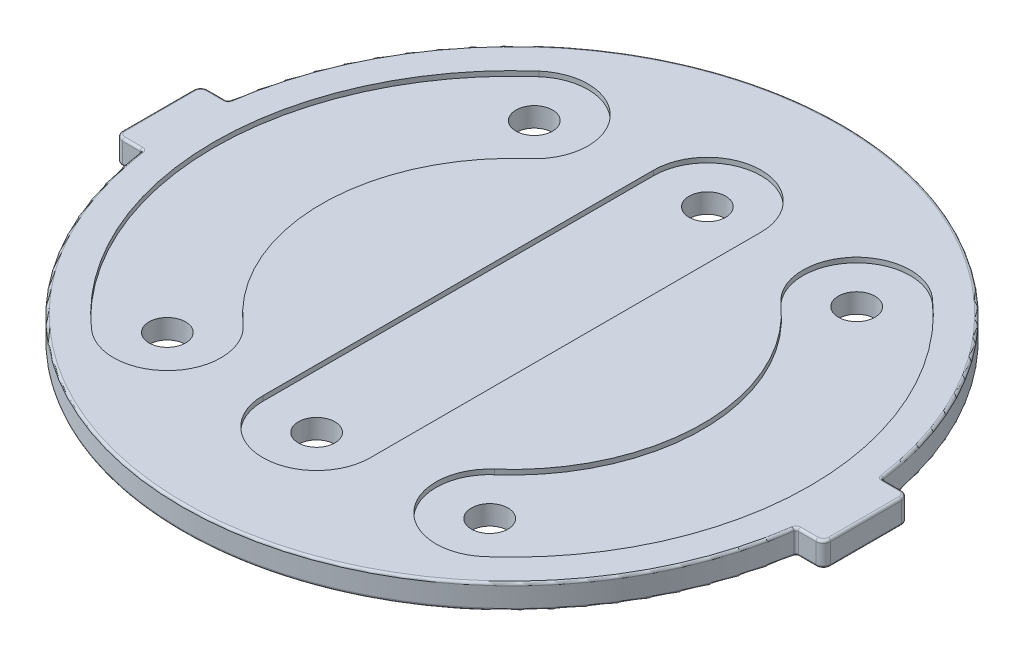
SolidWorks part; units mm, degrees
ref_plane "Front Plane" through (0, 0, 0) normal (0, 0, 1) x (1, 0, 0)
ref_plane "Top Plane" through (0, 0, 0) normal (0, 1, 0) x (1, 0, 0)
ref_plane "Right Plane" through (0, 0, 0) normal (1, 0, 0) x (0, 0, -1)
sketch "Sketch2" plane through (0, 0, 0) normal (0, 1, 0) x (-1, 0, 0)
  line L0 (0, 0) -> (100, 0) construction
  line L1 (0, 0) -> (0, -117.3978) construction
  line L2 (0, 80) -> (0, -80) construction
  line L3 (20, 80) -> (20, -80)
  line L4 (-20, 80) -> (-20, -80)
  line L6 (133.8609, 17.5) -> (145, 17.5)
  line L8 (133.8609, -17.5) -> (145, -17.5)
  line L9 (145, 17.5) -> (145, -17.5)
  line L10 (135, 0) -> (145, -17.5) construction
  line L11 (135, 0) -> (145, 17.5) construction
  line L12 (-145, 17.5) -> (-133.8609, 17.5)
  line L13 (-145, 17.5) -> (-145, -17.5)
  line L14 (-145, -17.5) -> (-133.8609, -17.5)
  line L16 (-145, 17.5) -> (-135, 0) construction
  line L17 (-145, -17.5) -> (-135, 0) construction
  arc A0 (65.9983, -75.128) -> (65.9983, 75.128) centre (0, 0) ccw construction
  arc A1 (79.198, -90.1536) -> (79.198, 90.1536) centre (0, 0) ccw
  arc A2 (52.7987, -60.1024) -> (52.7987, 60.1024) centre (0, 0) ccw
  arc A3 (52.7987, -60.1024) -> (79.198, -90.1536) centre (65.9983, -75.128) ccw
  arc A4 (79.198, 90.1536) -> (52.7987, 60.1024) centre (65.9983, 75.128) ccw
  arc A5 (-65.9983, -75.128) -> (-65.9983, 75.128) centre (0, 0) cw construction
  arc A6 (-79.198, -90.1536) -> (-79.198, 90.1536) centre (0, 0) cw
  arc A7 (-52.7987, -60.1024) -> (-52.7987, 60.1024) centre (0, 0) cw
  arc A8 (-52.7987, -60.1024) -> (-79.198, -90.1536) centre (-65.9983, -75.128) cw
  arc A9 (-79.198, 90.1536) -> (-52.7987, 60.1024) centre (-65.9983, 75.128) cw
  arc A10 (20, 80) -> (-20, 80) centre (0, 80) ccw
  arc A11 (-20, -80) -> (20, -80) centre (0, -80) ccw
  circle A12 centre (65.9983, 75.128) radius 7.5
  circle A13 centre (65.9983, -75.128) radius 7.5
  circle A14 centre (0, -80) radius 7.5
  circle A15 centre (0, 80) radius 7.5
  circle A16 centre (-65.9983, 75.128) radius 7.5
  circle A17 centre (-65.9983, -75.128) radius 7.5
  circle A18 centre (0, 0) radius 135
  point P4 (100, 0)
  point P14 (-100, 0)
  point P21 (0, 0)
  point P39 (135, 0)
  point P44 (-135, 0)
  dimension "D1" = 15
  dimension "D2" = 12.5
  dimension "D3" = 12.5
  dimension "D4" = 270
  dimension "D9" = 170
  dimension "D5" = 10
  dimension "D6" = 10
  dimension "D7" = 35
  dimension "D8" = 100
  dimension "D10" = 160
extrude "Extrude2" add sketch "Sketch2" along normal blind 10 contours A18 L8 L9 L6 | A18 L12 L13 L14 | A17 | A16 | A15 | A14 | A13 | A12
fillet "Fillet1" radius 3 4 edges at (-145, 5, -17.5) (-145, 5, 17.5) (145, 5, -17.5) (145, 5, 17.5)
fillet "Fillet2" radius 1 4 edges at (-133.8609, 5, -17.5) (-133.8609, 5, 17.5) (133.8609, 5, -17.5) (133.8609, 5, 17.5)
fillet "Fillet3" radius 1 32 edges at (-134.0786, 10, 17.7463) (-138.3679, 10, 17.5) (-144.1213, 10, 16.6213) (-145, 10, 0) (-144.1213, 10, -16.6213) (-138.3679, 10, -17.5) (-134.0786, 10, -17.7463) (0, 10, -135) (134.0786, 10, -17.7463) (138.3679, 10, -17.5) (144.1213, 10, -16.6213) (145, 10, 0) (144.1213, 10, 16.6213) (138.3679, 10, 17.5) (134.0786, 10, 17.7463) (-134.0786, 0, 17.7463) (-138.3679, 0, 17.5) (-144.1213, 0, 16.6213) (-145, 0, 0) (-144.1213, 0, -16.6213) (-138.3679, 0, -17.5) (-134.0786, 0, -17.7463) (0, 0, -135) (134.0786, 0, -17.7463) (138.3679, 0, -17.5) (144.1213, 0, -16.6213) (145, 0, 0) (144.1213, 0, 16.6213) (138.3679, 0, 17.5) (134.0786, 0, 17.7463) (0, 10, 135) (0, 0, 135)
sketch "Sketch3" plane through (0, 10, 0) normal (0, 1, 0) x (1, 0, 0)
  line L4 (-22, 80) -> (-22, -80)
  line L5 (22, -80) -> (22, 80)
  line L6 (-22, 80) -> (-22, -80)
  line L7 (22, -80) -> (22, 80)
  arc A8 (-51.4787, 58.5999) -> (-51.4787, -58.5999) centre (0, 0) ccw
  arc A9 (-80.5179, -91.6562) -> (-51.4787, -58.5999) centre (-65.9983, -75.128) ccw
  arc A10 (-80.5179, 91.6562) -> (-80.5179, -91.6562) centre (0, 0) ccw
  arc A11 (-51.4787, 58.5999) -> (-80.5179, 91.6562) centre (-65.9983, 75.128) ccw
  arc A12 (-51.4787, 58.5999) -> (-51.4787, -58.5999) centre (0, 0) ccw
  arc A13 (-80.5179, -91.6562) -> (-51.4787, -58.5999) centre (-65.9983, -75.128) ccw
  arc A14 (-80.5179, 91.6562) -> (-80.5179, -91.6562) centre (0, 0) ccw
  arc A15 (-51.4787, 58.5999) -> (-80.5179, 91.6562) centre (-65.9983, 75.128) ccw
  arc A16 (22, 80) -> (-22, 80) centre (0, 80) ccw
  arc A17 (-22, -80) -> (22, -80) centre (0, -80) ccw
  arc A18 (22, 80) -> (-22, 80) centre (0, 80) ccw
  arc A19 (-22, -80) -> (22, -80) centre (0, -80) ccw
  arc A26 (51.4787, -58.5999) -> (51.4787, 58.5999) centre (0, 0) ccw
  arc A27 (51.4787, -58.5999) -> (80.5179, -91.6562) centre (65.9983, -75.128) ccw
  arc A28 (80.5179, -91.6562) -> (80.5179, 91.6562) centre (0, 0) ccw
  arc A29 (80.5179, 91.6562) -> (51.4787, 58.5999) centre (65.9983, 75.128) ccw
  arc A30 (51.4787, -58.5999) -> (51.4787, 58.5999) centre (0, 0) ccw
  arc A31 (51.4787, -58.5999) -> (80.5179, -91.6562) centre (65.9983, -75.128) ccw
  arc A32 (80.5179, -91.6562) -> (80.5179, 91.6562) centre (0, 0) ccw
  arc A33 (80.5179, 91.6562) -> (51.4787, 58.5999) centre (65.9983, 75.128) ccw
  dimension "D1" = 2
  dimension "D2" = 2
  dimension "D3" = 2
extrude "Extrude3" cut sketch "Sketch3" against normal blind 2
